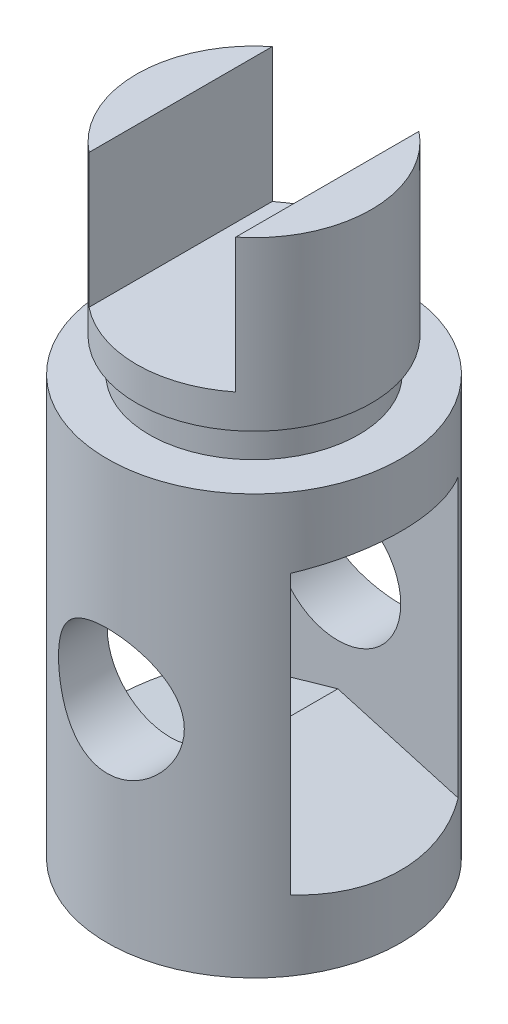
SolidWorks part; units mm, degrees
ref_plane "前视基准面" through (0, 0, 0) normal (0, 0, 1) x (1, 0, 0)
ref_plane "上视基准面" through (0, 0, 0) normal (0, 1, 0) x (1, 0, 0)
ref_plane "右视基准面" through (0, 0, 0) normal (1, 0, 0) x (0, 0, -1)
sketch "草图1" plane through (0, 0, 0) normal (0, 0, 1) x (1, 0, 0)
  line L0 (0, -91.5276) -> (0, 95.542) construction
  line L1 (0, -50) -> (-35, -50)
  line L2 (-35, -50) -> (-35, 50)
  line L3 (-35, 50) -> (-25, 50)
  line L4 (-25, 50) -> (-25, 58)
  line L5 (-25, 58) -> (-28, 58)
  line L6 (-28, 58) -> (-28, 98)
  line L7 (-28, 98) -> (0, 98)
  line L8 (0, 98) -> (0, -50)
  line L9 (0, 0) -> (-100.7606, 0) construction
  dimension "D1" = 100
  dimension "D2" = 8
  dimension "D3" = 40
  dimension "D4" = 35
  dimension "D5" = 25
  dimension "D6" = 28
revolve "旋转1" add sketch "草图1" angle 360 about L8
sketch "草图2" plane through (0, 0, 0) normal (0, 0, 1) x (1, 0, 0)
  line L0 (-66.9619, 0) -> (74.606, 0) construction
  line L1 (0, -61.0019) -> (0, 65.8894) construction
  line L2 (-35, 35) -> (0, 25)
  line L3 (-35, 50) -> (-35, -50) construction
  line L4 (0, 25) -> (35, 35)
  line L5 (35, -50) -> (35, 50) construction
  line L6 (35, 35) -> (35, -35)
  line L7 (35, -35) -> (0, -25)
  line L8 (0, -25) -> (-35, -35)
  line L9 (-35, -35) -> (-35, 35)
  dimension "D1" = 70
  dimension "D2" = 50
extrude "切除-拉伸1" cut sketch "草图2" against normal mid plane 40
sketch "草图3" plane through (0, 0, 0) normal (0, 0, 1) x (1, 0, 0)
  circle A0 centre (0, 0) radius 15
  dimension "D1" = 30
extrude "切除-拉伸2" cut sketch "草图3" against normal mid plane 100
sketch "草图4" plane through (0, 98, 0) normal (0, 1, 0) x (1, 0, 0)
  line L0 (0, -40.6374) -> (0, 39.6251) construction
  line L2 (-17.5, 38.3236) -> (17.5, 38.3236)
  line L3 (-17.5, 38.3236) -> (-17.5, -38.3236)
  line L4 (-17.5, -38.3236) -> (17.5, -38.3236)
  line L5 (17.5, 38.3236) -> (17.5, -38.3236)
  dimension "D1" = 35
extrude "切除-拉伸3" cut sketch "草图4" against normal blind 32
